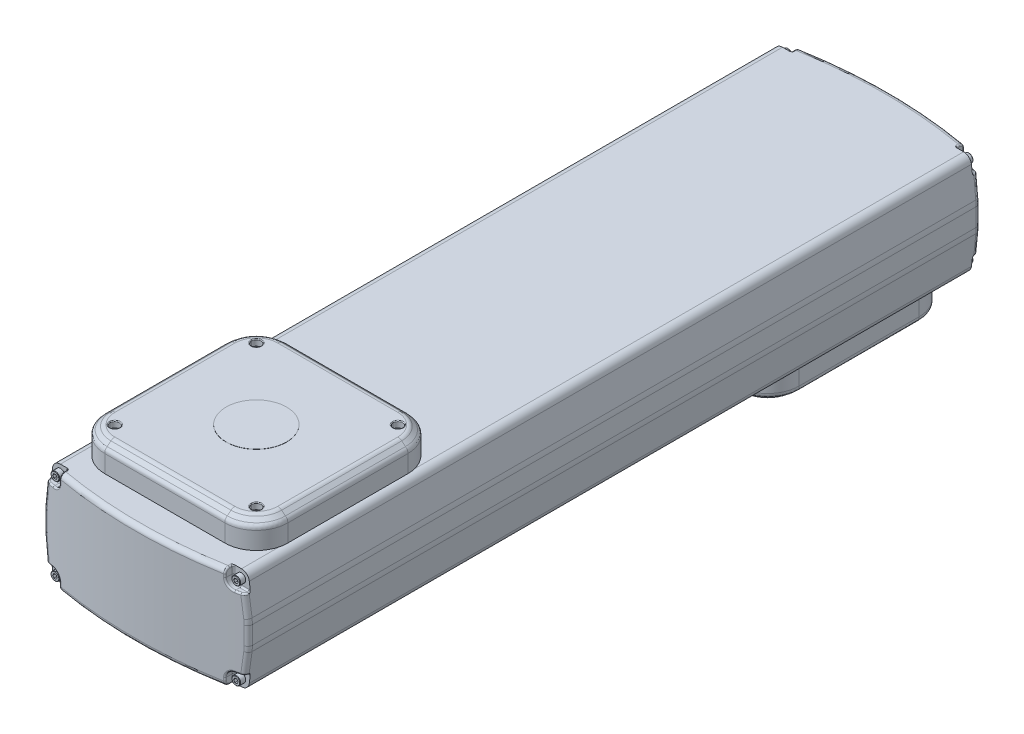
SolidWorks part; units mm, degrees
ref_plane "前视基准面" through (0, 0, 0) normal (0, 0, 1) x (1, 0, 0)
ref_plane "上视基准面" through (0, 0, 0) normal (0, 1, 0) x (1, 0, 0)
ref_plane "右视基准面" through (0, 0, 0) normal (1, 0, 0) x (0, 0, -1)
imported_body "MB10SC-600.sldasm-Part-1-1-solid1"
imported_body "MB10SC-600.sldasm-Part-2-1-solid1"
imported_body "MB10SC-600.sldasm-Part-3-1-solid1"
imported_body "MB10SC-600.sldasm-Part-4-1-solid1"
imported_body "MB10SC-600.sldasm-Part-5-1-solid1"
imported_body "MB10SC-600.sldasm-Part-6-1-solid1"
imported_body "MB10SC-600.sldasm-Part-7-1-solid1"
imported_body "MB10SC-600.sldasm-Part-8-1-solid1"
imported_body "MB10SC-600.sldasm-Part-9-1-solid1"
imported_body "MB10SC-600.sldasm-Part-10-1-solid1"
imported_body "MB10SC-600.sldasm-Part-11-1-solid1"
imported_body "MB10SC-600.sldasm-Part-12-1-solid1"
imported_body "MB10SC-600.sldasm-Part-13-1-solid1"
imported_body "MB10SC-600.sldasm-Part-14-1-solid1"
imported_body "MB10SC-600.sldasm-Part-15-1-solid1"
imported_body "MB10SC-600.sldasm-Part-16-1-solid1"
imported_body "MB10SC-600.sldasm-Part-17-1-solid1"
imported_body "MB10SC-600.sldasm-Part-18-1-solid1"
delete or keep bodies "实体-删除/保留 1" type keep bodies bodies 119
sketch "草图1" plane through (0, 244.3, 0) normal (0, 1, 0) x (1, 0, 0)
  circle A0 centre (0, 0) radius 19.2136
extrude "凸台-拉伸1" add sketch "草图1" along normal blind 0.1
sketch "草图2" plane through (0, 145.3, 0) normal (0, -1, 0) x (1, 0, 0)
  circle A0 centre (0, -325) radius 12.4051
extrude "凸台-拉伸2" add sketch "草图2" along normal blind 0.1
